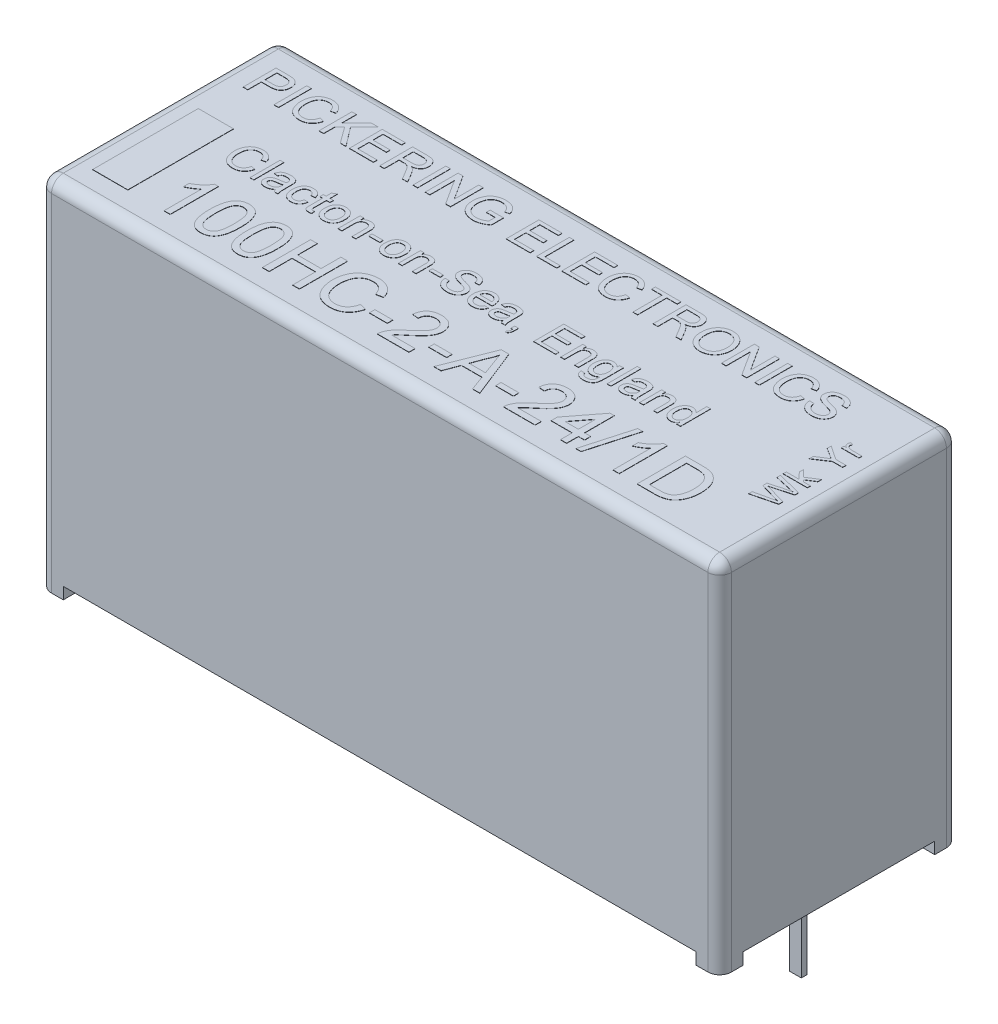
SolidWorks part; units mm, degrees
ref_plane "Front Plane" through (0, 0, 0) normal (0, 0, 1) x (1, 0, 0)
ref_plane "Top Plane" through (0, 0, 0) normal (0, 1, 0) x (1, 0, 0)
ref_plane "Right Plane" through (0, 0, 0) normal (1, 0, 0) x (0, 0, -1)
sketch "Sketch1" plane through (0, 0, 0) normal (0, 1, 0) x (1, 0, 0)
  line L1 (-14.478, -5.08) -> (14.478, -5.08)
  line L2 (-14.478, -5.08) -> (-14.478, 5.08)
  line L3 (-14.478, 5.08) -> (14.478, 5.08)
  line L4 (14.478, -5.08) -> (14.478, 5.08)
  line L5 (-14.478, -5.08) -> (14.478, 5.08) construction
  line L6 (-14.478, 5.08) -> (14.478, -5.08) construction
  point P0 (0, 0)
  dimension "D1" = 28.956
  dimension "D2" = 10.16
extrude "Boss-Extrude1" add sketch "Sketch1" along normal blind 15.24
sketch "Sketch2" plane through (0, 0, 5.08) normal (0, 0, 1) x (1, 0, 0)
  line L0 (-14.478, 0) -> (14.478, 0) construction
  line L1 (-13.478, 0) -> (13.478, 0)
  line L2 (-13.478, 0) -> (-13.478, 0.5)
  line L3 (-13.478, 0.5) -> (13.478, 0.5)
  line L4 (13.478, 0) -> (13.478, 0.5)
  line L5 (-14.478, 15.24) -> (-14.478, 0) construction
  line L6 (14.478, 15.24) -> (14.478, 0) construction
  dimension "D1" = 1
  dimension "D2" = 1
  dimension "D3" = 0.5
extrude "Cut-Extrude1" cut sketch "Sketch2" against normal through all
sketch "Sketch3" plane through (14.478, 0, 0) normal (1, 0, 0) x (0, 0, -1)
  line L0 (-5.08, 0) -> (5.08, 0) construction
  line L1 (-4.08, 0) -> (4.08, 0)
  line L2 (-4.08, 0) -> (-4.08, 0.5)
  line L3 (-4.08, 0.5) -> (4.08, 0.5)
  line L4 (4.08, 0) -> (4.08, 0.5)
  line L5 (-5.08, 15.24) -> (-5.08, 0) construction
  line L6 (5.08, 15.24) -> (5.08, 0) construction
  dimension "D1" = 1
  dimension "D2" = 1
  dimension "D3" = 0.5
extrude "Cut-Extrude2" cut sketch "Sketch3" against normal through all
sketch "Sketch4" plane through (0, 0.5, 0) normal (0, -1, 0) x (1, 0, 0)
  line L0 (-14.478, 0) -> (14.478, 0) construction
  line L1 (-14.478, -4.08) -> (-14.478, 4.08) construction
  line L2 (14.478, -4.08) -> (14.478, 4.08) construction
  line L4 (13.478, 5.08) -> (-13.478, 5.08) construction
  line L5 (0, 5.08) -> (0, -5.08) construction
  line L6 (13.478, -5.08) -> (-13.478, -5.08) construction
  line L7 (-2.8, -0.125) -> (-2.3, -0.125)
  line L8 (-2.8, -0.125) -> (-2.8, 0.125)
  line L9 (-2.8, 0.125) -> (-2.3, 0.125)
  line L10 (-2.3, -0.125) -> (-2.3, 0.125)
  line L11 (-2.8, -0.125) -> (-2.3, 0.125) construction
  line L12 (-2.8, 0.125) -> (-2.3, -0.125) construction
  line L13 (-7.9, -0.125) -> (-7.4, -0.125)
  line L14 (-7.9, -0.125) -> (-7.9, 0.125)
  line L15 (-7.9, 0.125) -> (-7.4, 0.125)
  line L16 (-7.4, -0.125) -> (-7.4, 0.125)
  line L17 (-7.9, -0.125) -> (-7.4, 0.125) construction
  line L18 (-7.9, 0.125) -> (-7.4, -0.125) construction
  line L19 (2.3, -0.125) -> (2.8, -0.125)
  line L20 (2.3, -0.125) -> (2.3, 0.125)
  line L21 (2.3, 0.125) -> (2.8, 0.125)
  line L22 (2.8, -0.125) -> (2.8, 0.125)
  line L23 (2.3, -0.125) -> (2.8, 0.125) construction
  line L24 (2.3, 0.125) -> (2.8, -0.125) construction
  line L25 (7.4, -0.125) -> (7.9, -0.125)
  line L26 (7.4, -0.125) -> (7.4, 0.125)
  line L27 (7.4, 0.125) -> (7.9, 0.125)
  line L28 (7.9, -0.125) -> (7.9, 0.125)
  line L29 (7.4, -0.125) -> (7.9, 0.125) construction
  line L30 (7.4, 0.125) -> (7.9, -0.125) construction
  line L31 (12.5, -0.125) -> (13, -0.125)
  line L32 (12.5, -0.125) -> (12.5, 0.125)
  line L33 (12.5, 0.125) -> (13, 0.125)
  line L34 (13, -0.125) -> (13, 0.125)
  line L35 (12.5, -0.125) -> (13, 0.125) construction
  line L36 (12.5, 0.125) -> (13, -0.125) construction
  line L37 (-13, -0.125) -> (-12.5, -0.125)
  line L38 (-13, -0.125) -> (-13, 0.125)
  line L39 (-13, 0.125) -> (-12.5, 0.125)
  line L40 (-12.5, -0.125) -> (-12.5, 0.125)
  line L41 (-13, -0.125) -> (-12.5, 0.125) construction
  line L42 (-13, 0.125) -> (-12.5, -0.125) construction
  point P6 (-2.55, 0)
  point P17 (-7.65, 0)
  point P22 (2.55, 0)
  point P27 (7.65, 0)
  point P32 (12.75, 0)
  point P37 (-12.75, 0)
  dimension "D1" = 5.1
  dimension "D2" = 5.1
  dimension "D3" = 5.1
  dimension "D4" = 0.5
  dimension "D5" = 0.25
  dimension "D6" = 5.1
  dimension "D7" = 5.1
extrude "Boss-Extrude2" add sketch "Sketch4" along normal blind 3.6854 separate body
fillet "Fillet2" radius 0.5 4 edges at (0, 15.24, 5.08) (-14.478, 15.24, 0) (0, 15.24, -5.08) (14.478, 15.24, 0)
fillet "Fillet3" radius 0.5 8 edges at (-14.3316, 15.0936, -4.9336) (14.3316, 15.0936, -4.9336) (14.3316, 15.0936, 4.9336) (-14.3316, 15.0936, 4.9336) (-14.478, 7.37, -5.08) (14.478, 7.37, -5.08) (14.478, 7.37, 5.08) (-14.478, 7.37, 5.08)
sketch "Sketch5" plane through (0, 15.24, 0) normal (0, 1, 0) x (1, 0, 0)
  line L0 (-13.478, 2.42) -> (10.7486, 2.42) construction
  line L1 (-11.228, -0.78) -> (8.6555, -0.78) construction
  line L2 (-11.228, -3.83) -> (12.0348, -3.83) construction
  line L3 (13.978, -5.08) -> (-13.978, -5.08) construction
  line L4 (-13.478, 0.67) -> (-11.978, 0.67)
  line L5 (-13.478, 0.67) -> (-13.478, -3.83)
  line L6 (-13.478, -3.83) -> (-11.978, -3.83)
  line L7 (-11.978, 0.67) -> (-11.978, -3.83)
  line L8 (-14.478, -4.58) -> (-14.478, 4.58) construction
  line L9 (13.478, -1.83) -> (13.478, 2.742) construction
  line L10 (14.478, 4.58) -> (14.478, -4.58) construction
  text T0 "PICKERING ELECTRONICS" font "Arial" height 1.4
  text T1 "Clacton-on-Sea, England" font "Arial" height in points 5
  text T2 "100HC-2-A-24/1D" font "Arial" height in points 8
  text T3 "Wk Yr" font "Arial" height in points 4
  dimension "D1" = 4.5
  dimension "D2" = 1.5
  dimension "D3" = 1.25
  dimension "D4" = 1
  dimension "D5" = 1.25
  dimension "D6" = 4.3
  dimension "D7" = 7.5
  dimension "D8" = 3.25
  dimension "D9" = 3.25
  dimension "D10" = 3.25
  dimension "D11" = 1
extrude "Print Details" add sketch "Sketch5" along normal blind 0.01 separate body
equation "\"1.251.20mm\"=1.2"
